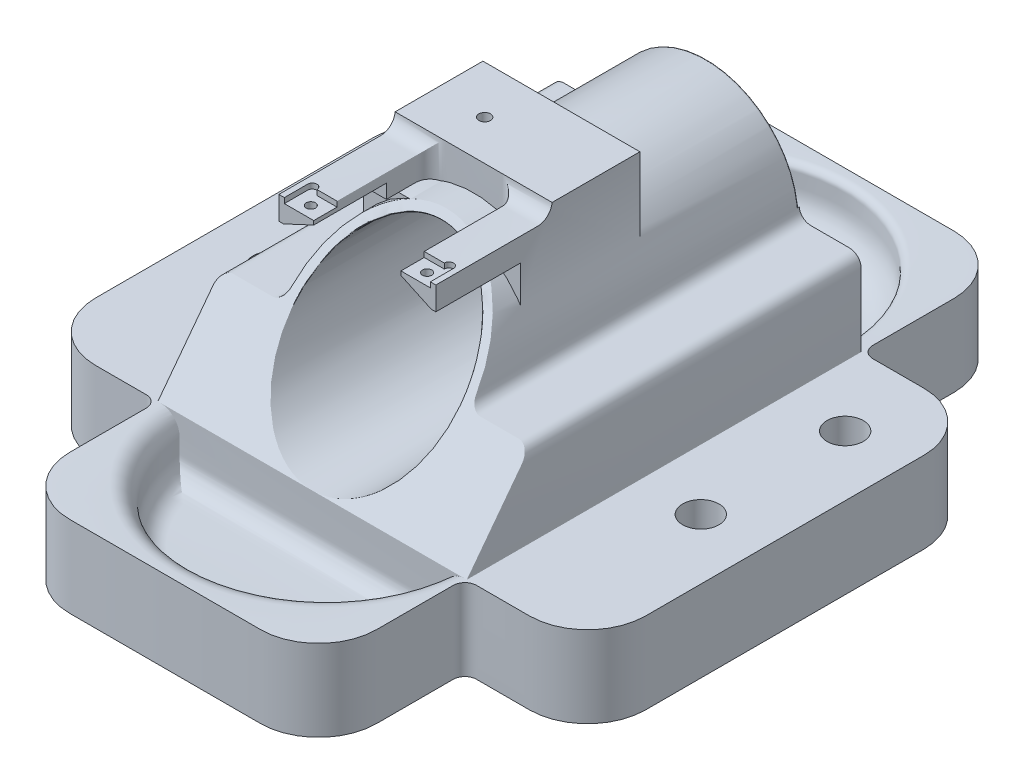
SolidWorks part; units mm, degrees
ref_plane "Front Plane" through (0, 0, 0) normal (0, 0, 1) x (1, 0, 0)
ref_plane "Top Plane" through (0, 0, 0) normal (0, 1, 0) x (1, 0, 0)
ref_plane "Right Plane" through (0, 0, 0) normal (1, 0, 0) x (0, 0, -1)
imported_body "Surface-Imported1"
scale "Scale2" scale about centroid uniform scaling yes scale factor 0.1
scale "Scale3" scale about centroid uniform scaling yes scale factor 0.1
scale "Scale4" scale about centroid uniform scaling yes scale factor 0.1
